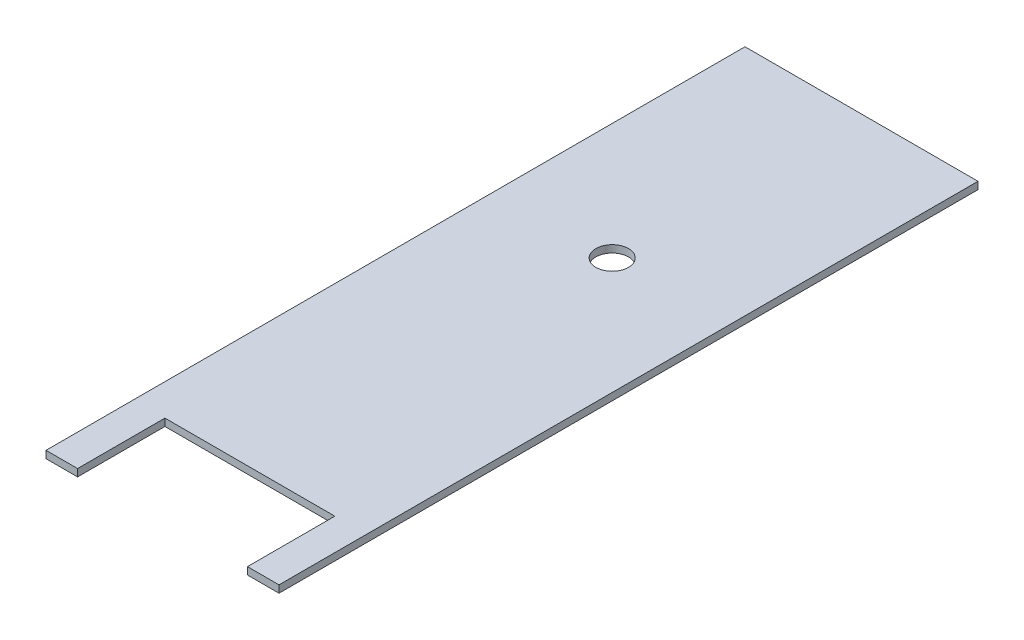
SolidWorks part; units mm, degrees
ref_plane "Front Plane" through (0, 0, 0) normal (0, 0, 1) x (1, 0, 0)
ref_plane "Top Plane" through (0, 0, 0) normal (0, 1, 0) x (1, 0, 0)
ref_plane "Right Plane" through (0, 0, 0) normal (1, 0, 0) x (0, 0, -1)
sketch "Sketch1" plane through (0, 0, 0) normal (0, 1, 0) x (1, 0, 0)
  line L1 (-76.2, -228.6) -> (76.2, -228.6)
  line L2 (-76.2, -228.6) -> (-76.2, 228.6)
  line L3 (-76.2, 228.6) -> (76.2, 228.6)
  line L4 (76.2, -228.6) -> (76.2, 228.6)
  line L5 (-76.2, -228.6) -> (76.2, 228.6) construction
  line L6 (-76.2, 228.6) -> (76.2, -228.6) construction
  point P0 (0, 0)
  dimension "D1" = 152.4
  dimension "D2" = 457.2
extrude "Boss-Extrude1" add sketch "Sketch1" along normal blind 4.7625
sketch "Sketch2" plane through (0, 4.7625, 0) normal (0, 1, 0) x (1, 0, 0)
  line L1 (76.2, 228.6) -> (-76.2, 228.6) construction
  line L2 (-76.2, -228.6) -> (76.2, -228.6) construction
  line L3 (-55.5625, -228.6) -> (55.5625, -228.6)
  line L4 (-55.5625, -228.6) -> (-55.5625, -171.45)
  line L5 (-55.5625, -171.45) -> (55.5625, -171.45)
  line L6 (55.5625, -228.6) -> (55.5625, -171.45)
  circle A0 centre (0, 65.532) radius 10.668
  point P8 (0, 76.2)
  point P12 (0, -171.45)
  dimension "D1" = 21.336
  dimension "D2" = 152.4
  dimension "D3" = 57.15
  dimension "D4" = 111.125
extrude "Cut-Extrude1" cut sketch "Sketch2" against normal through all
